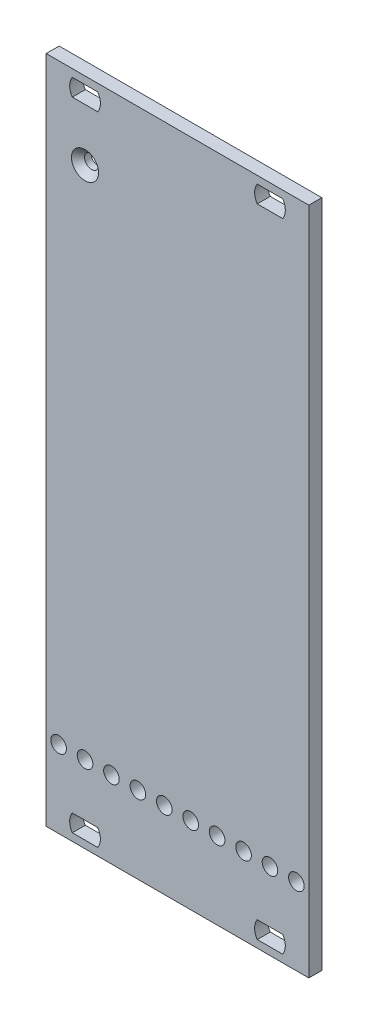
SolidWorks part; units mm, degrees
ref_plane "前视基准面" through (0, 0, 0) normal (0, 0, 1) x (1, 0, 0)
ref_plane "上视基准面" through (0, 0, 0) normal (0, 1, 0) x (1, 0, 0)
ref_plane "右视基准面" through (0, 0, 0) normal (1, 0, 0) x (0, 0, -1)
sketch "草图1" plane through (0, 0, 0) normal (0, 0, 1) x (1, 0, 0)
  line L1 (-25.25, 64.35) -> (25.25, 64.35)
  line L2 (-25.25, 64.35) -> (-25.25, -64.35)
  line L3 (-25.25, -64.35) -> (25.25, -64.35)
  line L4 (25.25, 64.35) -> (25.25, -64.35)
  line L5 (-25.25, 64.35) -> (25.25, -64.35) construction
  line L6 (-25.25, -64.35) -> (25.25, 64.35) construction
  point P0 (0, 0)
  dimension "D1" = 128.7
  dimension "D2" = 50.5
extrude "凸台-拉伸1" add sketch "草图1" against normal blind 2.5
sketch "草图3" plane through (0, 0, 0) normal (0, 0, 1) x (1, 0, 0)
  line L0 (-25.25, -49.5) -> (25.25, -49.5) construction
  line L1 (-25.25, 64.35) -> (-25.25, -64.35) construction
  line L2 (25.25, -64.35) -> (25.25, 64.35) construction
  line L3 (-25.25, -64.35) -> (25.25, -64.35) construction
  line L4 (0, 64.35) -> (0, -64.35) construction
  line L5 (25.25, 64.35) -> (-25.25, 64.35) construction
  line L6 (-25.25, 0) -> (25.25, 0) construction
  line L7 (-20.2254, 62.9) -> (-15.3346, 62.9)
  line L8 (-20.2254, 59.6) -> (-15.3346, 59.6)
  line L9 (20.2254, 59.6) -> (15.3346, 59.6)
  line L10 (20.2254, 62.9) -> (15.3346, 62.9)
  line L11 (20.2254, -62.9) -> (15.3346, -62.9)
  line L12 (20.2254, -59.6) -> (15.3346, -59.6)
  line L13 (-20.2254, -59.6) -> (-15.3346, -59.6)
  line L14 (-20.2254, -62.9) -> (-15.3346, -62.9)
  circle A0 centre (-17.78, -49.5) radius 1.5
  circle A1 centre (-22.86, -49.5) radius 1.5
  circle A2 centre (-12.7, -49.5) radius 1.5
  circle A3 centre (12.7, -49.5) radius 1.5
  circle A4 centre (22.86, -49.5) radius 1.5
  circle A5 centre (17.78, -49.5) radius 1.5
  arc A6 (-20.2254, 62.9) -> (-20.2254, 59.6) centre (-17.78, 61.25) ccw
  arc A7 (-15.3346, 59.6) -> (-15.3346, 62.9) centre (-17.78, 61.25) ccw
  arc A8 (15.3346, 59.6) -> (15.3346, 62.9) centre (17.78, 61.25) cw
  arc A9 (20.2254, 62.9) -> (20.2254, 59.6) centre (17.78, 61.25) cw
  arc A10 (20.2254, -62.9) -> (20.2254, -59.6) centre (17.78, -61.25) ccw
  arc A11 (15.3346, -59.6) -> (15.3346, -62.9) centre (17.78, -61.25) ccw
  arc A12 (-15.3346, -59.6) -> (-15.3346, -62.9) centre (-17.78, -61.25) cw
  arc A13 (-20.2254, -62.9) -> (-20.2254, -59.6) centre (-17.78, -61.25) cw
  circle A14 centre (-2.54, -49.5) radius 1.5
  circle A15 centre (-7.62, -49.5) radius 1.5
  circle A16 centre (7.62, -49.5) radius 1.5
  circle A17 centre (2.54, -49.5) radius 1.5
  circle A18 centre (-17.78, 49.5) radius 1.35
  dimension "D2" = 3
  dimension "D3" = 7.47
  dimension "D4" = 5.08
  dimension "D5" = 5.08
  dimension "D6" = 5.9
  dimension "D7" = 3.1
  dimension "D8" = 7.47
  dimension "D11" = 2.7
  dimension "D12" = 7.47
  dimension "D13" = 14.85
  dimension "D14" = 99
  dimension "D1" = 14.85
  dimension "D9" = 1.65
  dimension "D10" = 1.65
extrude "切除-拉伸2" cut sketch "草图3" against normal up to next
chamfer "倒角3" distance 1.25 angle 45 1 edges at (-16.43, 49.5, 0)
